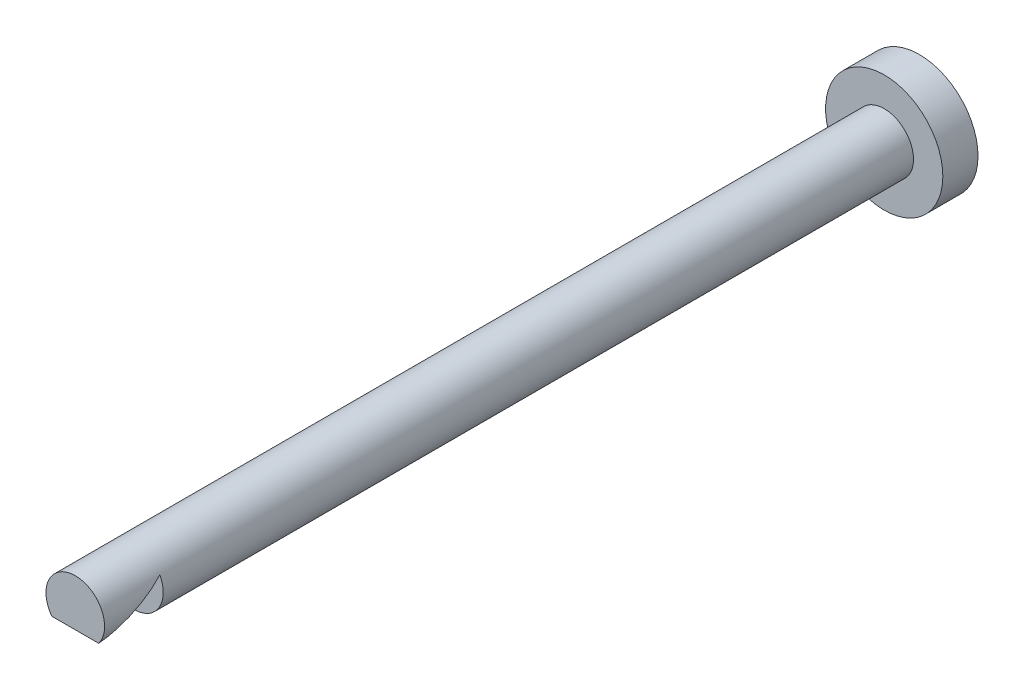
SolidWorks part; units mm, degrees
ref_plane "Plan de face" through (0, 0, 0) normal (0, 0, 1) x (1, 0, 0)
ref_plane "Plan de dessus" through (0, 0, 0) normal (0, 1, 0) x (1, 0, 0)
ref_plane "Plan de droite" through (0, 0, 0) normal (1, 0, 0) x (0, 0, -1)
sketch "Esquisse1" plane through (0, 0, 0) normal (0, 0, 1) x (1, 0, 0)
  circle A0 centre (0, 0) radius 5
  dimension "D1" = 10
extrude "Extrusion1" add sketch "Esquisse1" along normal blind 3
sketch "Esquisse2" plane through (0, 0, 3) normal (0, 0, 1) x (1, 0, 0)
  circle A0 centre (0, 0) radius 2.5
  dimension "D1" = 5
extrude "Extrusion2" add sketch "Esquisse2" along normal blind 69
sketch3d "Esquisse3D2"
  line L0 (0, -1.5, 72) -> (0, 1.1657, 67)
  line L1 (0, 1.1657, 67) -> (0, -2.5, 67)
  line L2 (0, -2.5, 67) -> (0, -2.5, 72)
  line L3 (0, -2.5, 72) -> (0, -1.5, 72)
  circle A0 centre (0, 0, 72) radius 2.5 construction
  point P6 (0, 0, 74.5)
  dimension "D1" = 5
  dimension "D2" = 1
extrude "Extrusion3" cut sketch "Esquisse3D2" along direction (1, 0, 0) on the side against the normal through all and the other way through all
